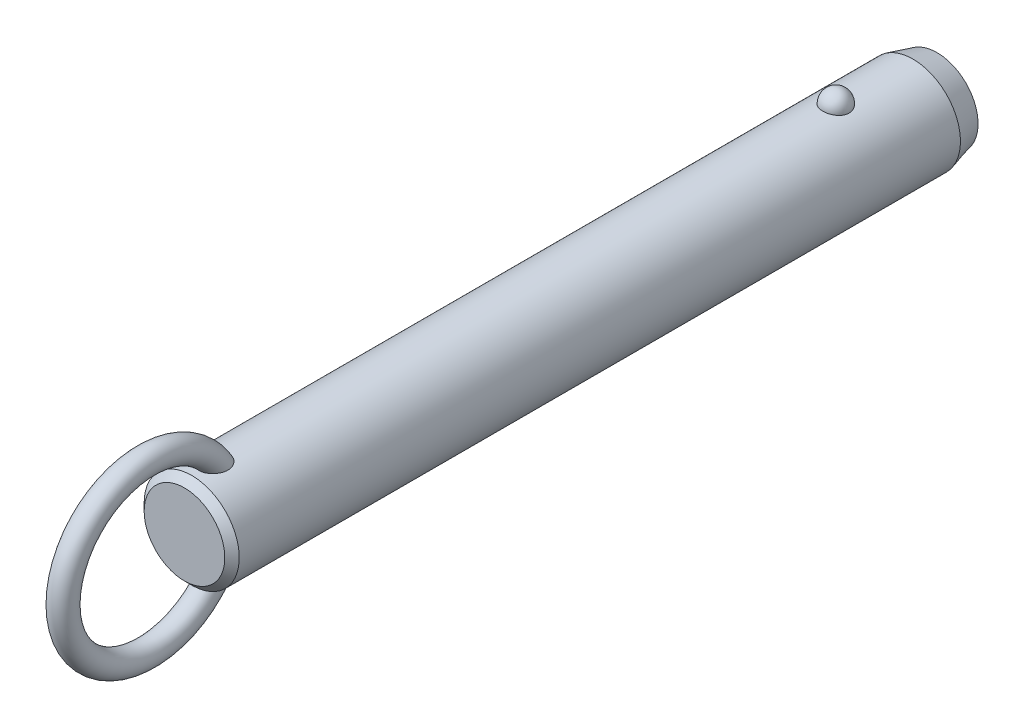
SolidWorks part; units mm, degrees
ref_plane "Front Plane" through (0, 0, 0) normal (0, 0, 1) x (1, 0, 0)
ref_plane "Top Plane" through (0, 0, 0) normal (0, 1, 0) x (1, 0, 0)
ref_plane "Right Plane" through (0, 0, 0) normal (1, 0, 0) x (0, 0, -1)
sketch "Sketch2" plane through (0, 0, 0) normal (0, 0, 1) x (1, 0, 0)
  circle A0 centre (0, 0) radius 7.9
  point P3 (0, 7.9)
  dimension "D1" = 15.8
extrude "Boss-Extrude1" add sketch "Sketch2" along normal blind 96.5
sketch "Sketch3" plane through (0, 0, 0) normal (0, 0, -1) x (-1, 0, 0)
  circle A0 centre (0, 0) radius 7.9
  dimension "D1" = 15.8
extrude "Boss-Extrude2" add sketch "Sketch3" along normal blind 19
chamfer "Chamfer1" distance 4 angle 15 1 edges at (-7.9, 0, -19)
sketch "Sketch12" plane through (0, 0, 0) normal (1, 0, 0) x (0, 0, -1)
  line L0 (-96.5, 7.9) -> (-96.5, -7.9) construction
  point P0 (-96.5, 0)
sketch "Sketch13" plane through (0, 0, 0) normal (1, 0, 0) x (0, 0, -1)
  circle A0 centre (-112.35, 0) radius 15.85
  point P2 (-96.5, 0)
  dimension "D1" = 31.7
sketch "Sketch14" plane through (0, 0, 0) normal (0, 1, 0) x (1, 0, 0)
  circle A0 centre (0, -98.5) radius 2
  point P2 (0, -96.5)
  dimension "D1" = 4
sweep "Sweep1" add profiles "Sketch14" path "Sketch13"
sketch "Sketch15" plane through (0, 0, 96.5) normal (0, 0, 1) x (1, 0, 0)
  circle A0 centre (0, 0) radius 7.9
  dimension "D1" = 15.8
extrude "Boss-Extrude3" add sketch "Sketch15" along normal blind 9.52
chamfer "Chamfer2" distance 1.2 angle 45 1 edges at (7.9, 0, 106.02)
sketch "Sketch18" plane through (0, 0, 0) normal (1, 0, 0) x (0, 0, -1)
  line L0 (15, 7.9) -> (-98.6091, 7.9) construction
  line L1 (2.2, 10.1) -> (2.2, 5.7)
  line L2 (-98.6091, -7.9) -> (15, -7.9) construction
  arc A0 (2.2, 10.1) -> (2.2, 5.7) centre (2.2, 7.9) ccw
  point P4 (0, 7.9)
  dimension "D1" = 18
revolve "Revolve1" add sketch "Sketch18" angle 360 about L1
